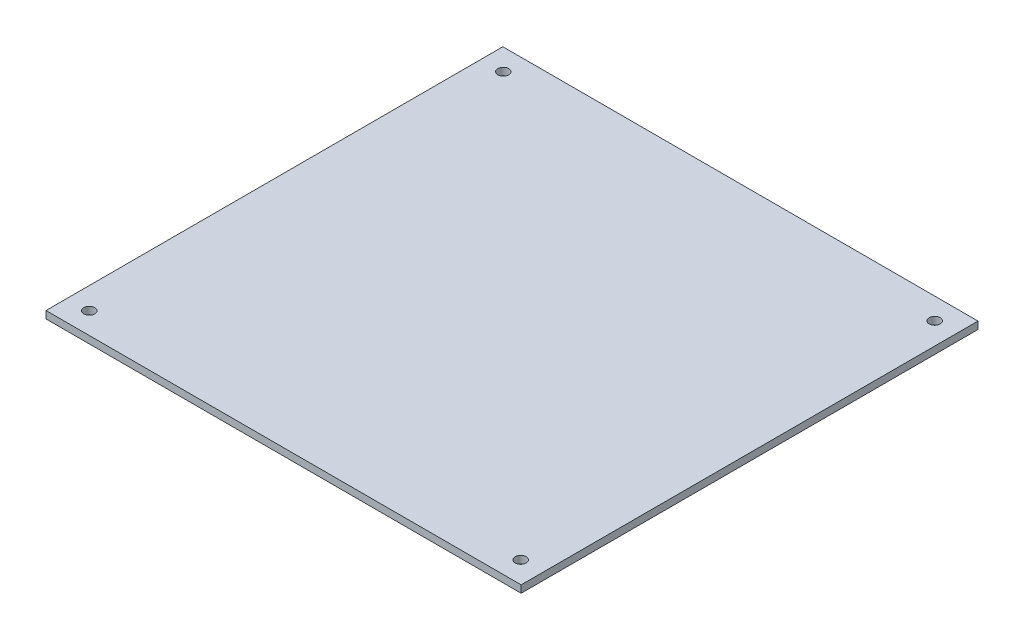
SolidWorks part; units mm, degrees
ref_plane "Front Plane" through (0, 0, 0) normal (0, 0, 1) x (1, 0, 0)
ref_plane "Top Plane" through (0, 0, 0) normal (0, 1, 0) x (1, 0, 0)
ref_plane "Right Plane" through (0, 0, 0) normal (1, 0, 0) x (0, 0, -1)
sketch "Esquisse1" plane through (0, 0, 0) normal (0, 1, 0) x (1, 0, 0)
  line L0 (66.0042, -62.6255) -> (66.0042, 62.3745)
  line L1 (66.0042, 62.3745) -> (-63.9958, 62.3745)
  line L2 (-63.9958, 62.3745) -> (-63.9958, -62.6255)
  line L3 (-63.9958, -62.6255) -> (66.0042, -62.6255)
  circle A0 centre (-58.0151, -56.7631) radius 1.5
  circle A1 centre (60.0235, -56.7631) radius 1.5
  circle A2 centre (60.0235, 56.5121) radius 1.5
  circle A3 centre (-58.0151, 56.5121) radius 1.5
extrude "Boss.-Extru.1" add sketch "Esquisse1" along normal blind 2
